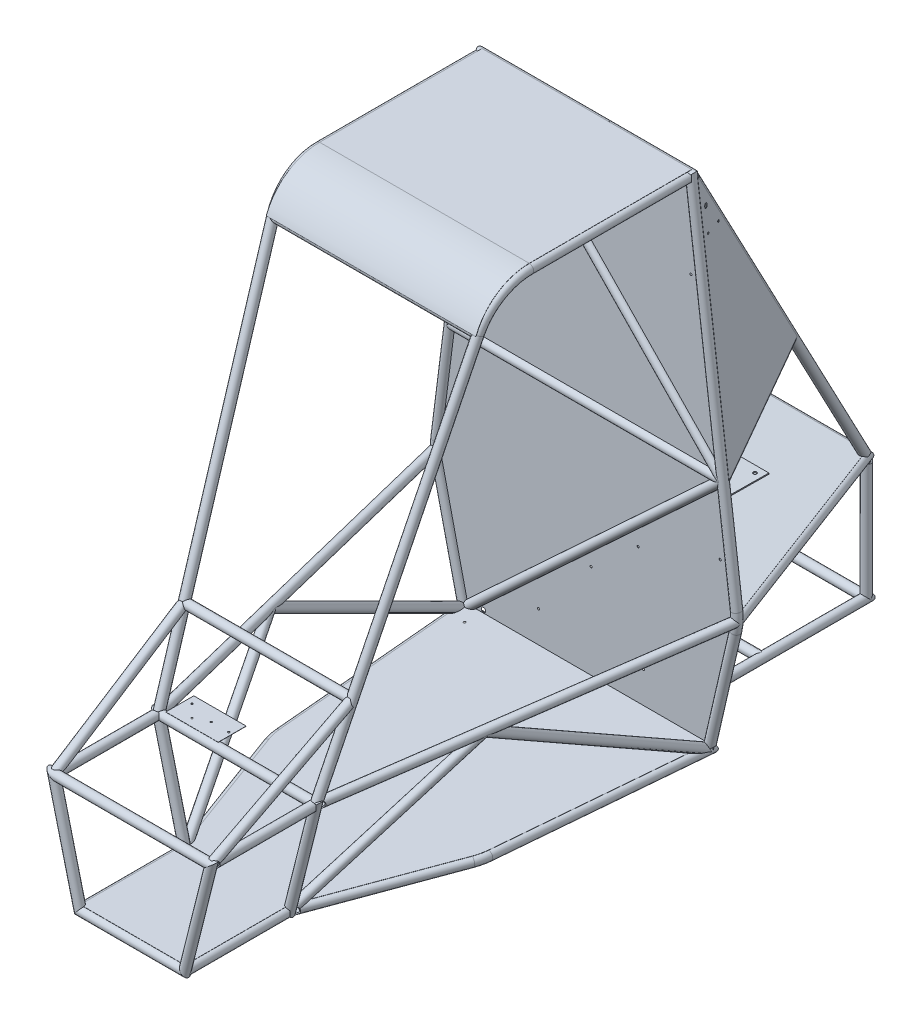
SolidWorks part; units mm, degrees
ref_plane "Front Plane" through (0, 0, 0) normal (0, 0, 1) x (1, 0, 0)
ref_plane "Top Plane" through (0, 0, 0) normal (0, 1, 0) x (1, 0, 0)
ref_plane "Right Plane" through (0, 0, 0) normal (1, 0, 0) x (0, 0, -1)
imported_body "BAJA_FINAL-1-solid1"
imported_body "BAJA_FINAL-1-solid2"
imported_body "BAJA_FINAL-1-solid3"
imported_body "BAJA_FINAL-1-solid4"
imported_body "BAJA_FINAL-1-solid5"
imported_body "BAJA_FINAL-1-solid6"
imported_body "BAJA_FINAL-1-solid7"
imported_body "BAJA_FINAL-1-solid8"
imported_body "BAJA_FINAL-1-solid9"
imported_body "BAJA_FINAL-1-solid10"
imported_body "BAJA_FINAL-1-solid11"
imported_body "BAJA_FINAL-1-solid12"
imported_body "BAJA_FINAL-1-solid13"
imported_body "BAJA_FINAL-1-solid14"
imported_body "BAJA_FINAL-1-solid15"
imported_body "BAJA_FINAL-1-solid16"
imported_body "BAJA_FINAL-1-solid17"
imported_body "BAJA_FINAL-1-solid18"
imported_body "BAJA_FINAL-1-solid19"
imported_body "BAJA_FINAL-1-solid20"
imported_body "BAJA_FINAL-1-solid21"
imported_body "BAJA_FINAL-1-solid22"
imported_body "BAJA_FINAL-1-solid23"
imported_body "BAJA_FINAL-1-solid24"
imported_body "BAJA_FINAL-1-solid25"
imported_body "BAJA_FINAL-1-solid26"
imported_body "BAJA_FINAL-1-solid27"
imported_body "BAJA_FINAL-1-solid28"
imported_body "BAJA_FINAL-1-solid29"
imported_body "BAJA_FINAL-1-solid30"
imported_body "BAJA_FINAL-1-solid31"
imported_body "BAJA_FINAL-1-solid32"
imported_body "BAJA_FINAL-1-solid33"
imported_body "BAJA_FINAL-1-solid34"
imported_body "BAJA_FINAL-1-solid35"
imported_body "BAJA_FINAL-1-solid36"
imported_body "BAJA_FINAL-1-solid37"
imported_body "BAJA_FINAL-1-solid38"
imported_body "BAJA_FINAL-1-solid39"
imported_body "BAJA_FINAL-1-solid40"
imported_body "BAJA_FINAL-1-solid41"
imported_body "BAJA_FINAL-1-solid42"
imported_body "BAJA_FINAL-1-solid43"
imported_body "BAJA_FINAL-1-solid44"
imported_body "BAJA_FINAL-1-solid45"
imported_body "BAJA_FINAL-1-solid46"
imported_body "BAJA_FINAL-1-solid47"
imported_body "BAJA_FINAL-1-solid48"
imported_body "BAJA_FINAL-1-solid49"
imported_body "BAJA_FINAL-1-solid50"
imported_body "BAJA_FINAL-1-solid51"
imported_body "BAJA_FINAL-1-solid52"
imported_body "sheetmetal cockpit base-1-solid1"
imported_body "sheetmetal_killswitch-1-solid1"
imported_body "sheetmetal_killswitch-2-solid1"
imported_body "sheet metal_firewall-1-solid1"
imported_body "sheetmetal_engine_batterybase-1-solid1"
imported_body "hood-1-solid1"
imported_body "hood-1-solid2"
imported_body "engine base-1-solid1"
imported_body "pressure switch mounting-1-solid1"
imported_body "pressure switch mounting-4-solid1"
imported_body "brake and reverse light mountings-1-solid1"
imported_body "killswitch and reverse sheet metal-1-solid1"
imported_body "reverse alarm mounting-2-solid1"
sketch "Sketch1" plane through (0, 0, -348.7572) normal (0, 0, 1) x (1, 0, 0)
  circle A0 centre (-325.0279, -661.5529) radius 6.25
  dimension "D1" = 12.5
extrude "Cut-Extrude1" cut sketch "Sketch1" against normal up to next
